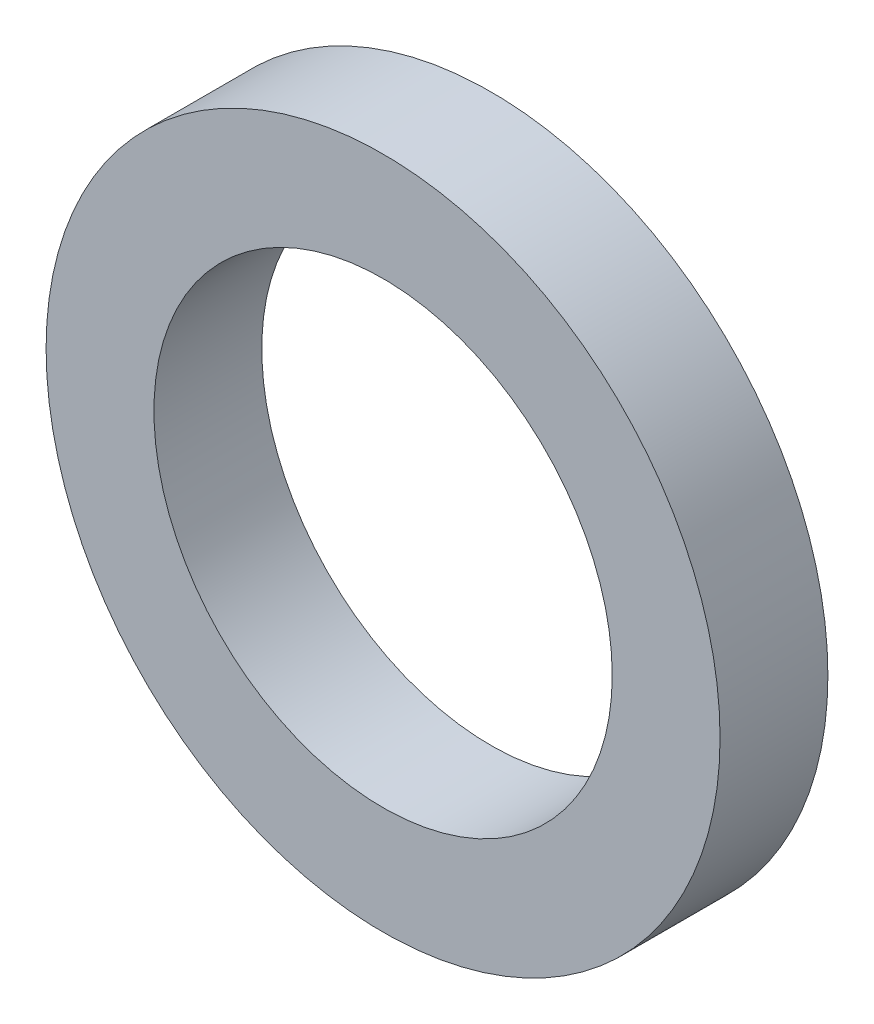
SolidWorks part; units mm, degrees
ref_plane "前视基准面" through (0, 0, 0) normal (0, 0, 1) x (1, 0, 0)
ref_plane "上视基准面" through (0, 0, 0) normal (0, 1, 0) x (1, 0, 0)
ref_plane "右视基准面" through (0, 0, 0) normal (1, 0, 0) x (0, 0, -1)
sketch "草图1" plane through (0, 0, 0) normal (0, 0, 1) x (1, 0, 0)
  circle A0 centre (0, 0) radius 8.5
  circle A1 centre (0, 0) radius 12.5
  dimension "D1" = 17
  dimension "D2" = 25
extrude "拉伸1" add sketch "草图1" along normal blind 4
